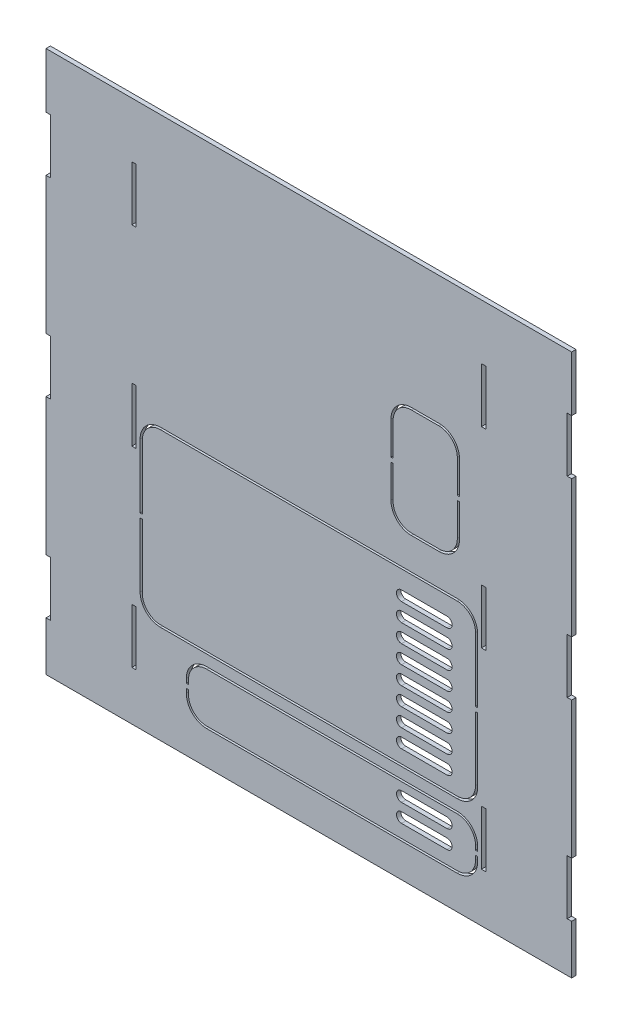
SolidWorks part; units mm, degrees
ref_plane "Front Plane" through (0, 0, 0) normal (0, 0, 1) x (1, 0, 0)
ref_plane "Top Plane" through (0, 0, 0) normal (0, 1, 0) x (1, 0, 0)
ref_plane "Right Plane" through (0, 0, 0) normal (1, 0, 0) x (0, 0, -1)
sketch "Sketch1" plane through (0, 0, 0) normal (0, 0, 1) x (1, 0, 0)
  line L0 (-29.9283, 36.8833) -> (-28.4043, 36.8833)
  line L1 (-29.9283, 189.7868) -> (153.3609, 189.7868)
  line L2 (-29.9283, 189.7868) -> (-29.9283, 170.5522)
  line L3 (-29.9283, 0.7102) -> (153.3609, 0.7102)
  line L4 (153.3609, 151.5022) -> (153.3609, 103.7177)
  line L5 (123.4325, 36.8833) -> (121.9085, 36.8833)
  line L6 (123.4325, 36.8833) -> (123.4325, 17.8333)
  line L7 (123.4325, 17.8333) -> (121.9085, 17.8333)
  line L8 (121.9085, 36.8833) -> (121.9085, 17.8333)
  line L9 (123.4325, 103.7177) -> (121.9085, 103.7177)
  line L10 (123.4325, 103.7177) -> (123.4325, 84.6677)
  line L11 (123.4325, 84.6677) -> (121.9085, 84.6677)
  line L12 (121.9085, 103.7177) -> (121.9085, 84.6677)
  line L13 (123.4325, 170.5522) -> (121.9085, 170.5522)
  line L14 (123.4325, 170.5522) -> (123.4325, 151.5022)
  line L15 (123.4325, 151.5022) -> (121.9085, 151.5022)
  line L16 (121.9085, 170.5522) -> (121.9085, 151.5022)
  line L17 (0, 170.5522) -> (1.524, 170.5522)
  line L18 (0, 170.5522) -> (0, 151.5022)
  line L19 (0, 151.5022) -> (1.524, 151.5022)
  line L20 (1.524, 170.5522) -> (1.524, 151.5022)
  line L21 (0, 103.7177) -> (1.524, 103.7177)
  line L22 (0, 103.7177) -> (0, 84.6677)
  line L23 (0, 84.6677) -> (1.524, 84.6677)
  line L24 (1.524, 103.7177) -> (1.524, 84.6677)
  line L25 (0, 36.8833) -> (1.524, 36.8833)
  line L26 (0, 36.8833) -> (0, 17.8333)
  line L27 (0, 17.8333) -> (1.524, 17.8333)
  line L28 (1.524, 36.8833) -> (1.524, 17.8333)
  line L29 (-29.9283, 170.5522) -> (-28.4043, 170.5522)
  line L30 (-29.9283, 17.8333) -> (-28.4043, 17.8333)
  line L31 (-29.9283, 103.7177) -> (-28.4043, 103.7177)
  line L32 (-28.4043, 170.5522) -> (-28.4043, 151.5022)
  line L33 (-29.9283, 17.8333) -> (-29.9283, 0.7102)
  line L34 (-29.9283, 84.6677) -> (-29.9283, 36.8833)
  line L35 (151.8369, 103.7177) -> (151.8369, 84.6677)
  line L36 (-29.9283, 151.5022) -> (-28.4043, 151.5022)
  line L37 (-29.9283, 84.6677) -> (-28.4043, 84.6677)
  line L38 (-28.4043, 36.8833) -> (-28.4043, 17.8333)
  line L39 (-28.4043, 103.7177) -> (-28.4043, 84.6677)
  line L40 (61.7163, 0.7102) -> (61.7163, -46.5864) construction
  line L41 (-29.9283, 151.5022) -> (-29.9283, 103.7177)
  line L42 (151.8369, 36.8833) -> (151.8369, 17.8333)
  line L43 (153.3609, 84.6677) -> (151.8369, 84.6677)
  line L44 (153.3609, 151.5022) -> (151.8369, 151.5022)
  line L45 (153.3609, 84.6677) -> (153.3609, 36.8833)
  line L46 (153.3609, 17.8333) -> (153.3609, 0.7102)
  line L47 (151.8369, 170.5522) -> (151.8369, 151.5022)
  line L48 (153.3609, 103.7177) -> (151.8369, 103.7177)
  line L49 (153.3609, 17.8333) -> (151.8369, 17.8333)
  line L50 (153.3609, 170.5522) -> (151.8369, 170.5522)
  line L51 (153.3609, 189.7868) -> (153.3609, 170.5522)
  line L52 (153.3609, 36.8833) -> (151.8369, 36.8833)
extrude "Boss-Extrude1" add sketch "Sketch1" along normal blind 1.524
sketch "Sketch2" plane through (0, 0, 1.524) normal (0, 0, 1) x (1, 0, 0)
  line L0 (109.9067, 19.5253) -> (94.0465, 19.5253) construction
  line L1 (9.9986, 35.7005) -> (113.5093, 35.7005)
  line L2 (3.6486, 42.0505) -> (3.6486, 64.3966)
  line L3 (9.9986, 94.6166) -> (113.5093, 94.6166)
  line L4 (119.8593, 42.0505) -> (119.8593, 64.3966)
  line L5 (26.104, 30.3621) -> (113.5093, 30.3621)
  line L6 (19.754, 24.0121) -> (19.754, 22.5307)
  line L7 (26.104, 13.1753) -> (113.5093, 13.1753)
  line L8 (119.8593, 24.0121) -> (119.8593, 22.5307)
  line L9 (109.9067, 17.7587) -> (94.0465, 17.7587)
  line L10 (109.9067, 21.2919) -> (94.0465, 21.2919)
  line L11 (109.9067, 25.8753) -> (94.0465, 25.8753) construction
  line L12 (109.9067, 24.1087) -> (94.0465, 24.1087)
  line L13 (109.9067, 27.6419) -> (94.0465, 27.6419)
  line L14 (109.9067, 42.0505) -> (94.0465, 42.0505) construction
  line L15 (109.9067, 40.2839) -> (94.0465, 40.2839)
  line L16 (109.9067, 43.8171) -> (94.0465, 43.8171)
  line L17 (109.9067, 48.4005) -> (94.0465, 48.4005) construction
  line L18 (109.9067, 46.6339) -> (94.0465, 46.6339)
  line L19 (109.9067, 50.1671) -> (94.0465, 50.1671)
  line L20 (109.9067, 54.7505) -> (94.0465, 54.7505) construction
  line L21 (109.9067, 52.9839) -> (94.0465, 52.9839)
  line L22 (109.9067, 56.5171) -> (94.0465, 56.5171)
  line L23 (109.9067, 61.1005) -> (94.0465, 61.1005) construction
  line L24 (109.9067, 59.3339) -> (94.0465, 59.3339)
  line L25 (109.9067, 62.8671) -> (94.0465, 62.8671)
  line L26 (109.9067, 67.4505) -> (94.0465, 67.4505) construction
  line L27 (109.9067, 65.6839) -> (94.0465, 65.6839)
  line L28 (109.9067, 69.2171) -> (94.0465, 69.2171)
  line L29 (109.9067, 73.8005) -> (94.0465, 73.8005) construction
  line L30 (109.9067, 72.0339) -> (94.0465, 72.0339)
  line L31 (109.9067, 75.5671) -> (94.0465, 75.5671)
  line L32 (109.9067, 80.1505) -> (94.0465, 80.1505) construction
  line L33 (109.9067, 78.3839) -> (94.0465, 78.3839)
  line L34 (109.9067, 81.9171) -> (94.0465, 81.9171)
  line L35 (109.9067, 86.5005) -> (94.0465, 86.5005) construction
  line L36 (109.9067, 84.7339) -> (94.0465, 84.7339)
  line L37 (109.9067, 88.2671) -> (94.0465, 88.2671)
  line L38 (26.104, 31.1241) -> (113.5093, 31.1241)
  line L39 (120.6213, 24.0121) -> (120.6213, 22.5307)
  line L40 (26.104, 12.4133) -> (113.5093, 12.4133)
  line L41 (18.992, 24.0121) -> (18.992, 22.5307)
  line L42 (9.9986, 95.3786) -> (113.5093, 95.3786)
  line L43 (120.6213, 42.0505) -> (120.6213, 64.3966)
  line L44 (9.9986, 34.9385) -> (113.5093, 34.9385)
  line L45 (2.8866, 42.0505) -> (2.8866, 64.3966)
  line L46 (3.6486, 65.9206) -> (3.6486, 88.2666)
  line L47 (3.6486, 65.9206) -> (2.8866, 65.9206)
  line L48 (3.6486, 64.3966) -> (2.8866, 64.3966)
  line L49 (2.8866, 65.9206) -> (2.8866, 88.2666)
  line L50 (3.6486, 42.0505) -> (3.6486, 88.2666) construction
  line L51 (19.754, 21.0067) -> (19.754, 19.5253)
  line L52 (2.8866, 42.0505) -> (2.8866, 88.2666) construction
  line L53 (18.992, 21.0067) -> (19.754, 21.0067)
  line L54 (18.992, 22.5307) -> (19.754, 22.5307)
  line L55 (18.992, 21.0067) -> (18.992, 19.5253)
  line L56 (19.754, 24.0121) -> (19.754, 19.5253) construction
  line L57 (120.6213, 21.0067) -> (120.6213, 19.5253)
  line L58 (18.992, 24.0121) -> (18.992, 19.5253) construction
  line L59 (119.8593, 21.0067) -> (120.6213, 21.0067)
  line L60 (119.8593, 22.5307) -> (120.6213, 22.5307)
  line L61 (119.8593, 21.0067) -> (119.8593, 19.5253)
  line L62 (120.6213, 24.0121) -> (120.6213, 19.5253) construction
  line L63 (120.6213, 65.9206) -> (120.6213, 88.2666)
  line L64 (119.8593, 24.0121) -> (119.8593, 19.5253) construction
  line L65 (119.8593, 64.3966) -> (120.6213, 64.3966)
  line L66 (119.8593, 65.9206) -> (120.6213, 65.9206)
  line L67 (119.8593, 65.9206) -> (119.8593, 88.2666)
  line L68 (120.6213, 42.0505) -> (120.6213, 88.2666) construction
  line L69 (114.2713, 113.5328) -> (114.2713, 124.9974)
  line L70 (119.8593, 42.0505) -> (119.8593, 88.2666) construction
  line L71 (107.1593, 107.1828) -> (97.4634, 107.1828)
  line L72 (113.5093, 113.5328) -> (113.5093, 124.9974)
  line L73 (107.1593, 144.336) -> (97.4634, 144.336)
  line L74 (91.1134, 113.5328) -> (91.1134, 124.9974)
  line L75 (107.1593, 145.098) -> (97.4634, 145.098)
  line L76 (90.3514, 113.5328) -> (90.3514, 124.9974)
  line L77 (107.1593, 106.4208) -> (97.4634, 106.4208)
  line L78 (113.5093, 124.9974) -> (114.2713, 124.9974)
  line L79 (90.3514, 124.9974) -> (91.1134, 124.9974)
  line L80 (90.3514, 126.5214) -> (91.1134, 126.5214)
  line L81 (113.5093, 126.5214) -> (114.2713, 126.5214)
  line L82 (113.5093, 126.5214) -> (113.5093, 137.986)
  line L83 (114.2713, 126.5214) -> (114.2713, 137.986)
  line L84 (113.5093, 113.5328) -> (113.5093, 137.986) construction
  line L85 (91.1134, 126.5214) -> (91.1134, 137.986)
  line L86 (114.2713, 113.5328) -> (114.2713, 137.986) construction
  line L87 (90.3514, 126.5214) -> (90.3514, 137.986)
  line L88 (91.1134, 113.5328) -> (91.1134, 137.986) construction
  line L90 (90.3514, 113.5328) -> (90.3514, 137.986) construction
  arc A0 (113.5093, 30.3621) -> (119.8593, 24.0121) centre (113.5093, 24.0121) cw
  arc A1 (113.5093, 13.1753) -> (119.8593, 19.5253) centre (113.5093, 19.5253) ccw
  arc A2 (26.104, 13.1753) -> (19.754, 19.5253) centre (26.104, 19.5253) cw
  arc A3 (26.104, 30.3621) -> (19.754, 24.0121) centre (26.104, 24.0121) ccw
  arc A4 (9.9986, 35.7005) -> (3.6486, 42.0505) centre (9.9986, 42.0505) cw
  arc A5 (113.5093, 35.7005) -> (119.8593, 42.0505) centre (113.5093, 42.0505) ccw
  arc A6 (113.5093, 94.6166) -> (119.8593, 88.2666) centre (113.5093, 88.2666) cw
  arc A7 (3.6486, 88.2666) -> (9.9986, 94.6166) centre (9.9986, 88.2666) cw
  arc A8 (109.9067, 17.7587) -> (109.9067, 21.2919) centre (109.9067, 19.5253) ccw
  arc A9 (94.0465, 21.2919) -> (94.0465, 17.7587) centre (94.0465, 19.5253) ccw
  arc A10 (109.9067, 24.1087) -> (109.9067, 27.6419) centre (109.9067, 25.8753) ccw
  arc A11 (94.0465, 27.6419) -> (94.0465, 24.1087) centre (94.0465, 25.8753) ccw
  arc A12 (109.9067, 40.2839) -> (109.9067, 43.8171) centre (109.9067, 42.0505) ccw
  arc A13 (94.0465, 43.8171) -> (94.0465, 40.2839) centre (94.0465, 42.0505) ccw
  arc A14 (109.9067, 46.6339) -> (109.9067, 50.1671) centre (109.9067, 48.4005) ccw
  arc A15 (94.0465, 50.1671) -> (94.0465, 46.6339) centre (94.0465, 48.4005) ccw
  arc A16 (109.9067, 52.9839) -> (109.9067, 56.5171) centre (109.9067, 54.7505) ccw
  arc A17 (94.0465, 56.5171) -> (94.0465, 52.9839) centre (94.0465, 54.7505) ccw
  arc A18 (109.9067, 59.3339) -> (109.9067, 62.8671) centre (109.9067, 61.1005) ccw
  arc A19 (94.0465, 62.8671) -> (94.0465, 59.3339) centre (94.0465, 61.1005) ccw
  arc A20 (109.9067, 65.6839) -> (109.9067, 69.2171) centre (109.9067, 67.4505) ccw
  arc A21 (94.0465, 69.2171) -> (94.0465, 65.6839) centre (94.0465, 67.4505) ccw
  arc A22 (109.9067, 72.0339) -> (109.9067, 75.5671) centre (109.9067, 73.8005) ccw
  arc A23 (94.0465, 75.5671) -> (94.0465, 72.0339) centre (94.0465, 73.8005) ccw
  arc A24 (109.9067, 78.3839) -> (109.9067, 81.9171) centre (109.9067, 80.1505) ccw
  arc A25 (94.0465, 81.9171) -> (94.0465, 78.3839) centre (94.0465, 80.1505) ccw
  arc A26 (109.9067, 84.7339) -> (109.9067, 88.2671) centre (109.9067, 86.5005) ccw
  arc A27 (94.0465, 88.2671) -> (94.0465, 84.7339) centre (94.0465, 86.5005) ccw
  arc A28 (113.5093, 31.1241) -> (120.6213, 24.0121) centre (113.5093, 24.0121) cw
  arc A29 (113.5093, 12.4133) -> (120.6213, 19.5253) centre (113.5093, 19.5253) ccw
  arc A30 (26.104, 12.4133) -> (18.992, 19.5253) centre (26.104, 19.5253) cw
  arc A31 (26.104, 31.1241) -> (18.992, 24.0121) centre (26.104, 24.0121) ccw
  arc A32 (113.5093, 95.3786) -> (120.6213, 88.2666) centre (113.5093, 88.2666) cw
  arc A33 (113.5093, 34.9385) -> (120.6213, 42.0505) centre (113.5093, 42.0505) ccw
  arc A34 (9.9986, 34.9385) -> (2.8866, 42.0505) centre (9.9986, 42.0505) cw
  arc A35 (2.8866, 88.2666) -> (9.9986, 95.3786) centre (9.9986, 88.2666) cw
  arc A36 (97.4634, 107.1828) -> (91.1134, 113.5328) centre (97.4634, 113.5328) cw
  arc A37 (107.1593, 107.1828) -> (113.5093, 113.5328) centre (107.1593, 113.5328) ccw
  arc A38 (113.5093, 137.986) -> (107.1593, 144.336) centre (107.1593, 137.986) ccw
  arc A39 (97.4634, 144.336) -> (91.1134, 137.986) centre (97.4634, 137.986) ccw
  arc A40 (114.2713, 137.986) -> (107.1593, 145.098) centre (107.1593, 137.986) ccw
  arc A41 (97.4634, 145.098) -> (90.3514, 137.986) centre (97.4634, 137.986) ccw
  arc A42 (97.4634, 106.4208) -> (90.3514, 113.5328) centre (97.4634, 113.5328) cw
  arc A43 (107.1593, 106.4208) -> (114.2713, 113.5328) centre (107.1593, 113.5328) ccw
  point P26 (101.9766, 19.5253)
  point P34 (101.9766, 25.8753)
  point P40 (101.9766, 42.0505)
  point P48 (101.9766, 48.4005)
  point P55 (101.9766, 54.7505)
  point P62 (101.9766, 61.1005)
  point P69 (101.9766, 67.4505)
  point P76 (101.9766, 73.8005)
  point P83 (101.9766, 80.1505)
  point P90 (101.9766, 86.5005)
  dimension "D1" = 6.35
  dimension "D5" = 6.35
  dimension "D4" = 0.762
  dimension "D6" = 0.762
  dimension "D2" = 2
  dimension "D3" = 8
extrude "Cut-Extrude1" cut sketch "Sketch2" against normal blind 1.524
